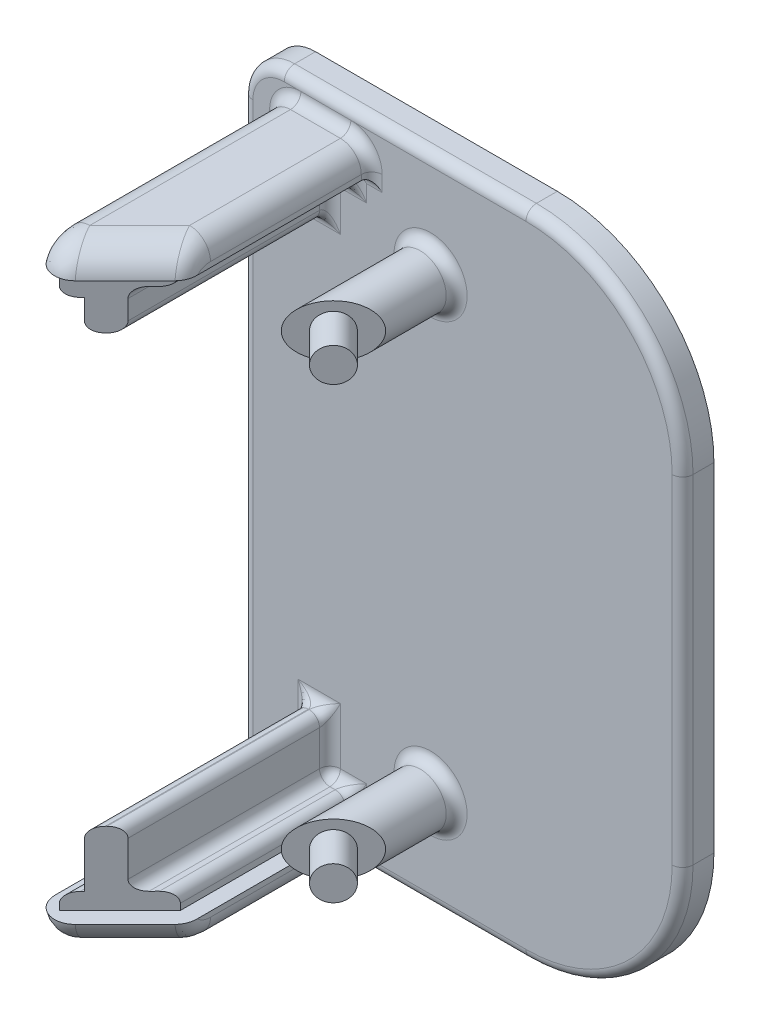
SolidWorks part; units mm, degrees
ref_plane "Front Plane" through (0, 0, 0) normal (0, 0, 1) x (1, 0, 0)
ref_plane "Top Plane" through (0, 0, 0) normal (0, 1, 0) x (1, 0, 0)
ref_plane "Right Plane" through (0, 0, 0) normal (1, 0, 0) x (0, 0, -1)
sketch "Sketch1" plane through (0, 0, 0) normal (0, 0, 1) x (1, 0, 0)
  circle A0 centre (49.5722, 9.7726) radius 2.5
  circle A1 centre (49.5722, 52.7726) radius 2.5
  dimension "D1" = 5
extrude "Boss-Extrude1" add sketch "Sketch1" along normal blind 12
sketch "Sketch2" plane through (0, 5.2784, 0) normal (0, -1, 0) x (1, 0, 0)
  line L1 (26.8033, 32.0723) -> (54.69, 32.0723)
  line L2 (26.8033, 32.0723) -> (52.2592, 6.6165)
  line L3 (26.8033, 32.0723) -> (52.2592, 6.6165)
  line L4 (54.69, 32.0723) -> (52.2592, 6.6165)
  dimension "D1" = 0.3
extrude "Cut-Extrude1" cut sketch "Sketch2" against normal through all
sketch "Sketch3" plane through (29.4378, 0, 29.4378) normal (0.7071, 0, 0.7071) x (0.7071, 0, -0.7071)
  circle A1 centre (28.4743, 9.7726) radius 1.625
  circle A2 centre (28.4743, 52.7726) radius 1.625
  dimension "D1" = 3.25
extrude "Boss-Extrude11" add sketch "Sketch3" along normal blind 4
sketch "Sketch4" plane through (0, 0, 0) normal (0, 0, 1) x (1, 0, 0)
  line L0 (52.4713, 5.2784) -> (52.4713, 57.2784) construction
  line L1 (52.4713, 31.2784) -> (11.8863, 31.2784) construction
  line L2 (34.7559, 5.2784) -> (28.1539, 5.2784) construction
  line L3 (28.1539, 5.2784) -> (27.0155, 5.2784) construction
  line L4 (32.7517, 5.2784) -> (28.1539, 5.2784)
  line L5 (28.1539, 5.2784) -> (27.0155, 5.2784)
  line L6 (32.7517, 6.2784) -> (28.1539, 6.2784)
  line L7 (28.1539, 6.2784) -> (27.442, 6.2784)
  line L8 (28.1539, 3.7784) -> (27.0155, 3.7784)
  line L9 (32.7517, 3.7784) -> (28.1539, 3.7784)
  line L10 (23.4633, 7.3919) -> (26.0211, 7.3919)
  line L11 (24.9889, 7.3919) -> (27.0155, 5.2784) construction
  line L12 (25.7107, 8.084) -> (27.442, 6.2784) construction
  line L14 (32.7517, 6.2784) -> (32.7517, 3.7784)
  line L15 (34.7559, 6.2784) -> (28.1539, 6.2784) construction
  line L16 (34.7559, 3.7784) -> (28.1539, 3.7784) construction
  line L17 (34.7559, 5.2784) -> (28.1539, 5.2784) construction
  ellipse E2 centre (27.0155, 8.2784) end of major axis (27.0155, 5.2784) minor radius 2.1213 (24.8941, 8.2784) -> (27.0155, 5.2784) ccw construction
  ellipse E3 centre (27.0155, 8.2784) end of major axis (27.0155, 5.2784) minor radius 2.1213 (24.9889, 7.3919) -> (27.0155, 5.2784) ccw
  spline S0 degree 2 poles (27.442, 6.2784) (26.2905, 6.2328) (26.0211, 7.3919) knots 0 0 0 1 1 1
  spline S2 degree 1 poles (23.5235, 7.0714) (27.0155, 3.7784) knots 0 0 1 1 construction
  spline S3 degree 3 poles (23.5235, 7.0714) (23.6144, 6.656) (23.8952, 5.8401) (24.6195, 4.7813) (25.6693, 3.989) (26.573, 3.7784) (27.0155, 3.7784) knots -1.270803 -1.270803 -1.270803 -1.270803 -0.953103 -0.635402 -0.317701 0 0 0 0 only from (23.4633, 7.3919) to (27.0155, 3.7784)
  dimension "D1" = 1
  dimension "D2" = 1.5
sketch "Sketch11" plane through (0, 0, 0) normal (0, 0, 1) x (1, 0, 0)
  line L0 (36.6555, 4.8807) -> (42.4348, 4.8807)
  line L1 (37.8555, 6.4807) -> (37.8555, 11.8807)
  line L2 (39.9348, 6.4807) -> (39.9348, 11.8807)
  line L3 (52.4713, 31.2784) -> (11.8863, 31.2784) construction
  line L4 (39.9348, 11.8807) -> (37.8555, 11.8807)
  line L5 (39.9348, 11.8807) -> (39.9348, 60.1878) construction
  line L6 (36.6555, 6.4807) -> (36.6555, 60.9475) construction
  line L7 (37.8555, 6.4807) -> (36.6555, 6.4807)
  line L8 (36.6555, 4.8807) -> (36.6555, 6.4807)
  line L9 (37.8555, 11.8807) -> (37.8555, 60.1878) construction
  line L10 (42.4348, 6.4807) -> (42.4348, 61.454) construction
  line L11 (39.9348, 6.4807) -> (42.4348, 6.4807)
  line L12 (42.4348, 4.8807) -> (42.4348, 6.4807)
  line L13 (36.6555, 58.2559) -> (42.4348, 58.2559)
  line L14 (42.4348, 58.2559) -> (42.4348, 56.6559)
  line L15 (42.4348, 56.6559) -> (39.9348, 56.6559)
  line L16 (39.9348, 56.6559) -> (39.9348, 52.8014)
  line L17 (39.9348, 52.8014) -> (37.8555, 52.8014)
  line L18 (37.8555, 52.8014) -> (37.8555, 55.7559)
  line L19 (37.8555, 55.7559) -> (36.6555, 55.7559)
  line L20 (36.6555, 55.7559) -> (36.6555, 58.2559)
  dimension "D1" = 1.6
  dimension "D2" = 2.5
  dimension "D3" = 1.6
  dimension "D4" = 1.6
  dimension "D5" = 1.2
extrude "Boss-Extrude9" add sketch "Sketch11" along normal blind 23
sketch "Sketch12" plane through (0, 5.2784, 0) normal (0, -1, 0) x (1, 0, 0)
  line L0 (43.1151, 16.1445) -> (35.3217, 23.9883)
  line L1 (35.3217, 23.9883) -> (38.352, 26.0464)
  line L2 (38.352, 26.0464) -> (51.5805, 20.4517)
  line L3 (51.5805, 20.4517) -> (43.1151, 16.1445)
extrude "Cut-Extrude6" cut sketch "Sketch12" against normal up to surface and the other way up to surface
sketch "Sketch13" plane through (0, 0, 0) normal (0, 0, 1) x (1, 0, 0)
  line L0 (42.4348, 6.4807) -> (42.4348, 4.8807) construction
  line L1 (35.1555, 2.3807) -> (35.1555, 4.8807)
  line L2 (43.9348, 4.8807) -> (43.9348, 2.3807)
  line L3 (43.9348, 2.3807) -> (35.1555, 2.3807)
  line L4 (35.1555, 4.8807) -> (43.9348, 4.8807)
  line L6 (52.4713, 31.2784) -> (11.8863, 31.2784) construction
  line L7 (52.4713, 5.2784) -> (52.4713, 57.2784) construction
  line L8 (43.9348, 58.2717) -> (43.9348, 60.7717)
  line L9 (43.9348, 60.7717) -> (35.1555, 60.7717)
  line L10 (43.9348, 58.2717) -> (35.1555, 58.2717)
  line L11 (35.1555, 58.2717) -> (35.1555, 60.7717)
  dimension "D1" = 2.5
  dimension "D2" = 2.5
  dimension "D3" = 1.5
extrude "Boss-Extrude10" add sketch "Sketch13" along normal blind 27
sketch "Sketch14" plane through (0, 5.2784, 0) normal (0, 1, 0) x (1, 0, 0)
  line L0 (45.0913, -16.4713) -> (34.4268, -27.15)
  line L1 (34.4268, -27.15) -> (42.7839, -30.8366)
  line L2 (42.7839, -30.8366) -> (51.6362, -30.1219)
  line L3 (51.6362, -30.1219) -> (53.9172, -23.7765)
  line L4 (53.9172, -23.7765) -> (45.0913, -16.4713)
extrude "Cut-Extrude7" cut sketch "Sketch14" against normal blind 26 and the other way through all
fillet "Fillet1" radius 3 1 edges at (39.5452, 2.3807, 22.0248)
fillet "Fillet2" radius 2 4 edges at (43.9348, 3.0894, 16.1837) (35.1555, 2.3807, 11.1171) (43.9348, 2.3807, 6.7216) (35.1555, 3.0894, 24.9746)
ref_plane "Plane1" through (0, 31.2784, 0) normal (0, 1, 0) x (0, 0, 1)
fillet "Fillet3" radius 3 1 edges at (39.5452, 60.7717, 22.0248)
fillet "Fillet4" radius 2 4 edges at (35.1555, 60.063, 24.9746) (43.9348, 60.063, 16.1837) (35.1555, 60.7717, 11.1171) (43.9348, 60.7717, 6.7216)
sketch "Sketch15" plane through (0, 0, 0) normal (0, 0, 1) x (1, 0, 0)
  line L0 (37.1555, 60.7717) -> (41.9348, 60.7717) construction
  line L1 (31.5543, 62.7717) -> (73.7149, 62.7717)
  line L2 (31.5543, 62.7717) -> (31.5543, 0.3807)
  line L3 (31.5543, 0.3807) -> (73.7149, 0.3807)
  line L4 (73.7149, 62.7717) -> (73.7149, 0.3807)
  line L5 (41.9348, 2.3807) -> (37.1555, 2.3807) construction
  dimension "D1" = 2
  dimension "D2" = 2
extrude "Boss-Extrude12" add sketch "Sketch15" against normal blind 3
fillet "Fillet5" radius 1 34 edges at (43.9348, 58.5217, 0) (43.3491, 60.1859, 0) (39.5452, 60.7717, 0) (35.7413, 60.1859, 0) (35.1555, 58.5217, 0) (39.5452, 58.2717, 0) (37.8555, 54.2787, 0) (38.8952, 52.8014, 0) (39.9348, 54.7287, 0) (41.1848, 56.6559, 0) (42.4348, 57.4559, 0) (39.5452, 58.2559, 0) (36.6555, 57.0059, 0) (37.2555, 55.7559, 0) (41.1848, 6.4807, 0) (39.9348, 9.1807, 0) (38.8952, 11.8807, 0) (37.8555, 9.1807, 0) (37.2555, 6.4807, 0) (35.1555, 4.6307, 0) (35.7413, 2.9664, 0) (39.5452, 2.3807, 0) (43.3491, 2.9664, 0) (43.9348, 4.6307, 0) (52.6346, 62.7717, 0) (73.7149, 31.5762, 0) (52.6346, 0.3807, 0) (31.5543, 31.5762, 0) (52.0722, 9.7726, 0) (52.0722, 52.7726, 0)
sketch "Sketch16" plane through (0, 0, 0) normal (0, 0, 1) x (1, 0, 0)
  line L0 (312.859, 85.3333) -> (312.859, 426.6667) construction
  line L1 (62.5608, 29.675) -> (62.5608, 31.1627) construction
  line L2 (61.7928, 30.4188) -> (63.2926, 30.4188) construction
  line L3 (62.5608, 25.9828) -> (70.3387, 25.9828)
  line L4 (66.4498, 27.9433) -> (70.3568, 27.9433)
  line L5 (66.4498, 27.9433) -> (68.5103, 29.7833)
  line L6 (65.0779, 34.3387) -> (70.3568, 34.3387)
  line L7 (70.3568, 27.9433) -> (70.3568, 32.5408) construction
  line L8 (66.4643, 32.5408) -> (70.3568, 32.5408)
  line L9 (70.3568, 30.2421) -> (71.0775, 30.2421) construction
  line L10 (68.4297, 30.7607) -> (66.4643, 32.5408)
  circle A0 centre (62.5608, 30.4188) radius 0.7318
  arc A1 (60.8747, 31.758) -> (64.0861, 31.9387) centre (62.5608, 30.4188) ccw
  arc A2 (58.9245, 32.9596) -> (62.5608, 25.9828) centre (62.5608, 30.4188) ccw
  spline S0 degree 3 poles (60.812, 31.675) (61.2115, 32.1405) (60.8075, 33.725) (59.2728, 33.419) (58.9245, 32.9596) knots 0 0 0 0 0.502783 1 1 1 1
  spline S1 degree 3 poles (70.3387, 25.9828) (70.8165, 26.026) (71.462, 26.9742) (70.8039, 27.8735) (70.3568, 27.9433) knots 0 0 0 0 0.510068 1 1 1 1
  spline S2 degree 2 poles (68.5103, 29.7833) (68.9741, 30.2552) (68.4297, 30.7607) knots 0 0 0 1 1 1
  spline S3 degree 3 poles (64.0861, 31.9387) (63.8582, 32.2965) (63.5699, 33.4196) (64.531, 34.2166) (65.0779, 34.3387) knots 0 0 0 0 0.42958 1 1 1 1
  spline S4 degree 3 poles (70.3568, 32.5408) (70.6394, 32.565) (71.041, 32.8626) (71.188, 33.5143) (70.9761, 34.1013) (70.5887, 34.3348) (70.3568, 34.3387) knots 0 0 0 0 0.321053 0.517682 0.738255 1 1 1 1
fillet "Fillet6" radius 15 4 edges at (73.422, 0.6735, -0.2929) (73.422, 62.4788, -0.2929) (73.7149, 62.7717, -2) (73.7149, 0.3807, -2)
fillet "Fillet7" radius 4 4 edges at (31.8472, 62.4788, -0.2929) (31.8472, 0.6735, -0.2929) (31.5543, 0.3807, -2) (31.5543, 62.7717, -2)
fillet "Fillet8" radius 1 10 edges at (36.3626, 6.7735, 0.2929) (37.5626, 12.1735, 0.2929) (40.2277, 12.1735, 0.2929) (40.2277, 6.7735, 0.2929) (42.7277, 6.7735, 0.2929) (36.6555, 6.4807, 11.8229) (37.8555, 11.8807, 11.219) (39.9348, 11.8807, 10.1727) (39.9348, 6.4807, 10.1727) (42.4348, 6.4807, 8.9146)
fillet "Fillet9" radius 1 10 edges at (42.7277, 56.363, 0.2929) (40.2277, 56.363, 0.2929) (40.2277, 52.5085, 0.2929) (37.5626, 52.5085, 0.2929) (36.3626, 55.463, 0.2929) (42.4348, 56.6559, 8.9146) (39.9348, 56.6559, 10.1727) (39.9348, 52.8014, 10.1727) (37.8555, 52.8014, 11.219) (36.6555, 55.7559, 11.8229)
